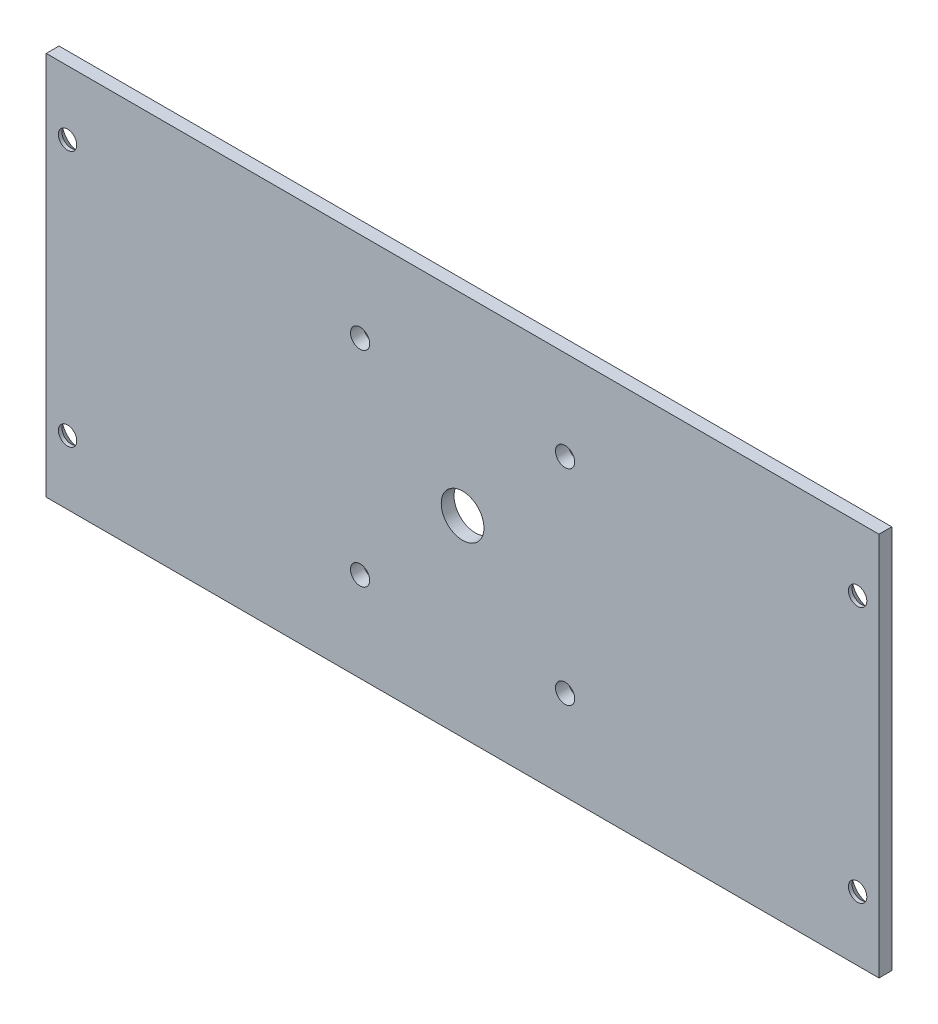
SolidWorks part; units mm, degrees
ref_plane "Спереди" through (0, 0, 0) normal (0, 0, 1) x (1, 0, 0)
ref_plane "Сверху" through (0, 0, 0) normal (0, 1, 0) x (1, 0, 0)
ref_plane "Справа" through (0, 0, 0) normal (1, 0, 0) x (0, 0, -1)
sketch "Эскиз1" plane through (0, 0, 0) normal (0, 0, 1) x (1, 0, 0)
  line L1 (0, 0) -> (195, 0)
  line L2 (0, 0) -> (0, 90)
  line L3 (0, 90) -> (195, 90)
  line L4 (195, 0) -> (195, 90)
  dimension "D1" = 90
  dimension "D2" = 195
extrude "Бобышка-Вытянуть1" add sketch "Эскиз1" along normal blind 3
sketch "Эскиз2" plane through (0, 0, 0) normal (0, 0, -1) x (-1, 0, 0)
  line L0 (-97.5, 103.0195) -> (-97.5, -17.2428) construction
  line L1 (-195, 90) -> (0, 90) construction
  line L2 (-195, 0) -> (-195, 90) construction
  circle A0 centre (-190, 75) radius 4.3
  circle A1 centre (-190, 15) radius 4.3
  circle A2 centre (-5, 75) radius 4.3
  circle A3 centre (-5, 15) radius 4.3
  point P12 (-97.5, 90)
  dimension "D1" = 8.6
  dimension "D2" = 8.6
  dimension "D3" = 8.6
  dimension "D4" = 8.6
  dimension "D5" = 5
  dimension "D6" = 5
  dimension "D7" = 60
  dimension "D8" = 15
extrude "Вырез-Вытянуть1" cut sketch "Эскиз2" against normal blind 2.15
draft "Уклон1" type of draft neutral plane draft angle 45 faces to draft 4 parameters "D1"=45
sketch "Эскиз3" plane through (0, 0, 2.15) normal (0, 0, -1) x (-1, 0, 0)
  circle A0 centre (-190, 75) radius 2.15
  dimension "D1" = 4.3
extrude "Вырез-Вытянуть2" cut sketch "Эскиз3" against normal through all
sketch "Эскиз4" plane through (0, 0, 2.15) normal (0, 0, -1) x (-1, 0, 0)
  circle A0 centre (-190, 15) radius 2.15
  dimension "D1" = 4.3
extrude "Вырез-Вытянуть3" cut sketch "Эскиз4" against normal through all
sketch "Эскиз5" plane through (0, 0, 2.15) normal (0, 0, -1) x (-1, 0, 0)
  circle A0 centre (-5, 75) radius 2.15
  dimension "D1" = 4.3
extrude "Вырез-Вытянуть4" cut sketch "Эскиз5" against normal through all
sketch "Эскиз6" plane through (0, 0, 2.15) normal (0, 0, -1) x (-1, 0, 0)
  circle A0 centre (-5, 15) radius 2.15
  dimension "D1" = 4.3
extrude "Вырез-Вытянуть5" cut sketch "Эскиз6" against normal through all
sketch "Эскиз7" plane through (0, 0, 0) normal (0, 0, -1) x (-1, 0, 0)
  line L0 (-97.5, 97.53) -> (-97.5, -5.973) construction
  line L1 (-195, 90) -> (0, 90) construction
  line L2 (-204.0995, 45) -> (11.2639, 45) construction
  line L3 (-195, 0) -> (-195, 90) construction
  circle A0 centre (-121.5, 69) radius 2.25
  circle A1 centre (-121.5, 21) radius 2.25
  circle A2 centre (-73.5, 69) radius 2.25
  circle A3 centre (-73.5, 21) radius 2.25
  circle A4 centre (-97.5, 45) radius 5
  point P4 (-97.5, 90)
  point P17 (-195, 45)
  dimension "D1" = 4.5
  dimension "D2" = 4.5
  dimension "D3" = 4.5
  dimension "D4" = 4.5
  dimension "D7" = 10
  dimension "D5" = 48
  dimension "D6" = 48
extrude "Вырез-Вытянуть6" cut sketch "Эскиз7" against normal through all
